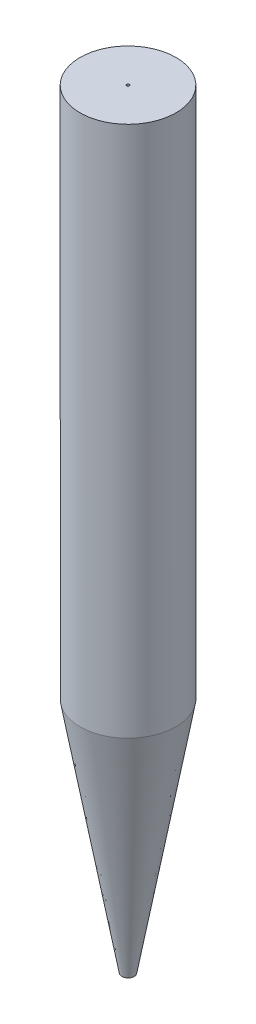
SolidWorks part; units mm, degrees
ref_plane "Front Plane" through (0, 0, 0) normal (0, 0, 1) x (1, 0, 0)
ref_plane "Top Plane" through (0, 0, 0) normal (0, 1, 0) x (1, 0, 0)
ref_plane "Right Plane" through (0, 0, 0) normal (1, 0, 0) x (0, 0, -1)
sketch "Sketch2" plane through (0, 0, 0) normal (0, 0, 1) x (1, 0, 0)
  line L0 (0.7925, 3.9182) -> (0.1016, 0)
  line L1 (0.7925, 3.9182) -> (0.7925, 12.7)
  line L2 (0.7925, 12.7) -> (0, 12.7)
  line L3 (0, 12.7) -> (0, 0)
  line L4 (0, 0) -> (0, 17.3482) construction
  line L5 (0.1016, 0) -> (0, 0)
  line L6 (0, 0) -> (0, -0.2314) construction
  dimension "D1" = 0.2032
  dimension "D2" = 12.7
  dimension "D3" = 1.585
  dimension "D4" = 10
revolve "Revolve1" add sketch "Sketch2" angle 360 about L4
sketch "Sketch3" plane through (0, 12.7, 0) normal (0, 1, 0) x (1, 0, 0)
  circle A0 centre (0, 0) radius 0.0229
  dimension "D1" = 0.0457
extrude "Cut-Extrude1" cut sketch "Sketch3" against normal up to next
